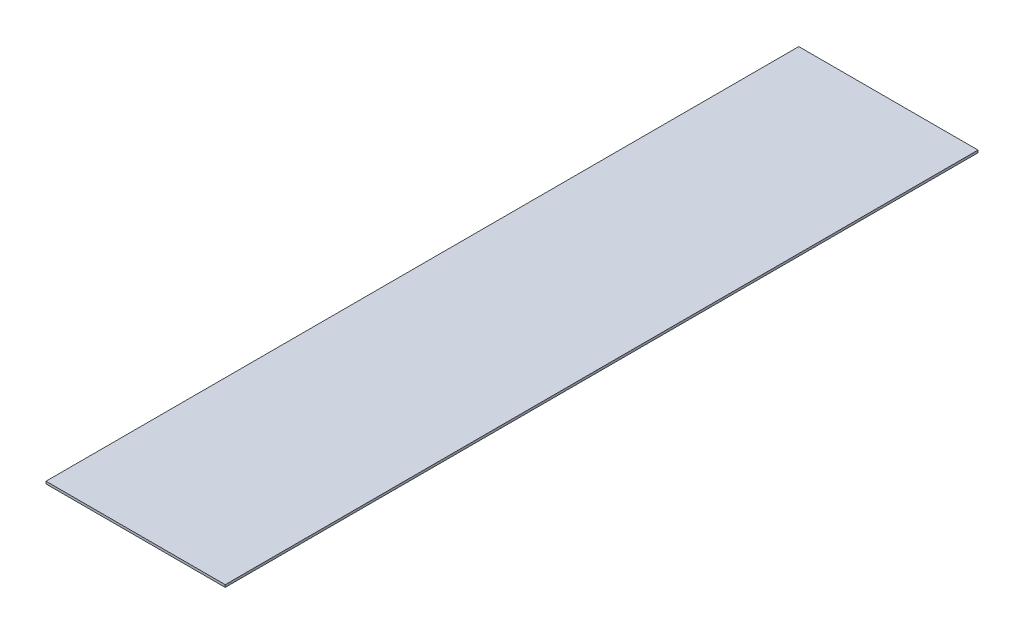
SolidWorks part; units mm, degrees
ref_plane "Front" through (0, 0, 0) normal (0, 0, 1) x (1, 0, 0)
ref_plane "Top" through (0, 0, 0) normal (0, 1, 0) x (1, 0, 0)
ref_plane "Right" through (0, 0, 0) normal (1, 0, 0) x (0, 0, -1)
sketch "Sketch2" plane through (0, 0, 0) normal (0, 1, 0) x (1, 0, 0)
  line L0 (-3.2997, 17.8938) -> (-3.2997, -14.1102)
  line L1 (4.3197, 17.8938) -> (4.3197, -14.1102)
  line L2 (-3.2997, 17.8938) -> (4.3197, 17.8938)
  line L3 (-3.2997, -14.1102) -> (4.3197, -14.1102)
extrude "Extrude1" add sketch "Sketch2" along normal blind 0.1016
